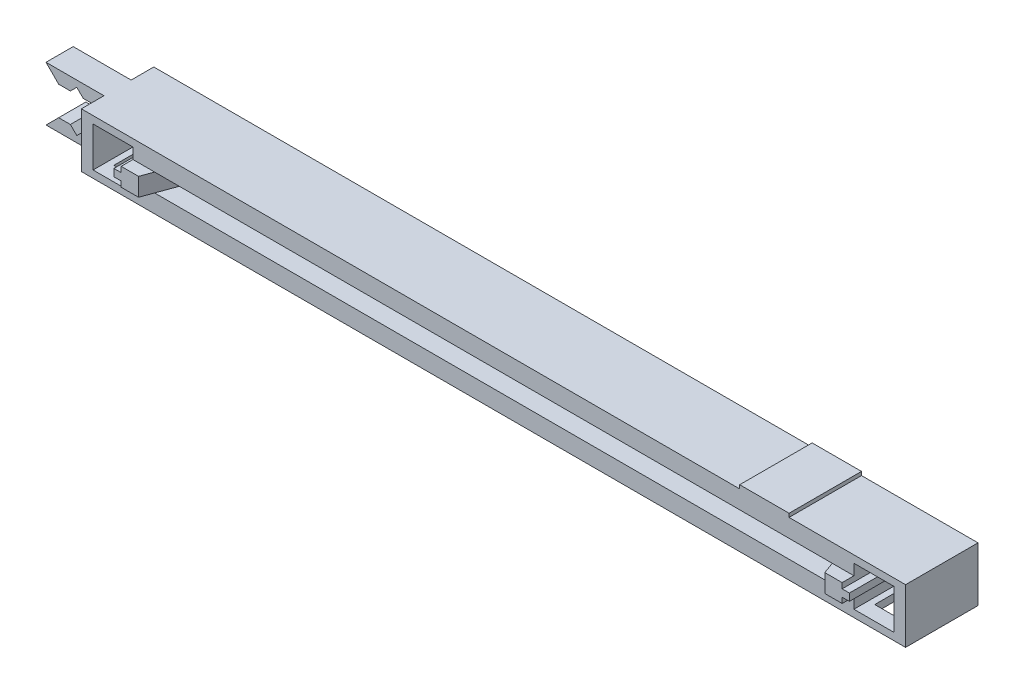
SolidWorks part; units mm, degrees
ref_plane "前视基准面" through (0, 0, 0) normal (0, 0, 1) x (1, 0, 0)
ref_plane "上视基准面" through (0, 0, 0) normal (0, 1, 0) x (1, 0, 0)
ref_plane "右视基准面" through (0, 0, 0) normal (1, 0, 0) x (0, 0, -1)
sketch "草图1" plane through (0, 0, 0) normal (0, 0, 1) x (1, 0, 0)
  line L1 (17.5, 15) -> (-17.5, 15)
  line L2 (17.5, 15) -> (17.5, -15)
  line L3 (17.5, -15) -> (-17.5, -15)
  line L4 (-17.5, 15) -> (-17.5, -15)
  line L5 (17.5, 15) -> (-17.5, -15) construction
  line L6 (17.5, -15) -> (-17.5, 15) construction
  point P0 (0, 0)
  dimension "D1" = 30
  dimension "D2" = 35
extrude "凸台-拉伸1" add sketch "草图1" along normal mid plane 40
sketch "草图2" plane through (-17.5, 0, 0) normal (-1, 0, 0) x (0, 0, 1)
  line L1 (7.5, 7.5) -> (-7.5, 7.5)
  line L2 (7.5, 7.5) -> (7.5, -7.5)
  line L3 (7.5, -7.5) -> (-7.5, -7.5)
  line L4 (-7.5, 7.5) -> (-7.5, -7.5)
  line L5 (7.5, 7.5) -> (-7.5, -7.5) construction
  line L6 (7.5, -7.5) -> (-7.5, 7.5) construction
  point P0 (0, 0)
  dimension "D1" = 15
  dimension "D2" = 15
extrude "凸台-拉伸2" add sketch "草图2" along normal blind 385
sketch "草图3" plane through (-402.5, 0, 0) normal (-1, 0, 0) x (0, 0, 1)
  line L4 (-20, 15) -> (-20, -15)
  line L5 (-20, -15) -> (20, -15)
  line L6 (20, -15) -> (20, 15)
  line L7 (20, 15) -> (-20, 15)
  line L8 (-20, 15) -> (-20, -15)
  line L9 (-20, -15) -> (20, -15)
  line L10 (20, -15) -> (20, 15)
  line L11 (20, 15) -> (-20, 15)
  dimension "D1" = 0
extrude "凸台-拉伸3" add sketch "草图3" along normal blind 35
sketch "草图4" plane through (0, 0, 20) normal (0, 0, 1) x (1, 0, 0)
  line L1 (11, 11) -> (-11, 11)
  line L2 (11, 11) -> (11, -11)
  line L3 (11, -11) -> (-11, -11)
  line L4 (-11, 11) -> (-11, -11)
  line L5 (11, 11) -> (-11, -11) construction
  line L6 (11, -11) -> (-11, 11) construction
  point P0 (0, 0)
  dimension "D1" = 22
  dimension "D2" = 22
extrude "切除-拉伸1" cut sketch "草图4" against normal blind 40
sketch "草图5" plane through (0, 0, 20) normal (0, 0, 1) x (1, 0, 0)
  line L0 (-437.5, 15) -> (-402.5, 15) construction
  line L1 (-409, 11) -> (-431, 11)
  line L2 (-409, 11) -> (-409, -11)
  line L3 (-409, -11) -> (-431, -11)
  line L4 (-431, 11) -> (-431, -11)
  line L5 (-409, 11) -> (-431, -11) construction
  line L6 (-409, -11) -> (-431, 11) construction
  line L7 (-437.5, -15) -> (-437.5, 15) construction
  point P0 (-420, 0)
  dimension "D1" = 22
  dimension "D2" = 22
  dimension "D3" = 4
  dimension "D4" = 6.5
extrude "切除-拉伸2" cut sketch "草图5" against normal blind 40
sketch "草图7" plane through (0, -15, 0) normal (0, -1, 0) x (1, 0, 0)
  line L1 (-420, 20) -> (-420, -20) construction
  line L2 (-437.5, 20) -> (-402.5, 20) construction
  line L3 (-437.5, -20) -> (-402.5, -20) construction
  line L5 (-412.5, 12) -> (-427.5, 12)
  line L6 (-412.5, 12) -> (-412.5, -12)
  line L7 (-412.5, -12) -> (-427.5, -12)
  line L8 (-427.5, 12) -> (-427.5, -12)
  line L9 (-412.5, 12) -> (-427.5, -12) construction
  line L10 (-412.5, -12) -> (-427.5, 12) construction
  point P0 (-420, 0)
  dimension "D1" = 8
  dimension "D2" = 15
extrude "切除-拉伸4" cut sketch "草图7" against normal blind 10
sketch "草图8" plane through (0, 0, 0) normal (0, 1, 0) x (1, 0, 0)
  line L0 (-392.5, 7.5) -> (-399.4154, 26.5)
  line L1 (-402.5, 7.5) -> (-17.5, 7.5) construction
  line L2 (-399.4154, 26.5) -> (-409, 26.5)
  line L3 (-409, 26.5) -> (-409, 20)
  line L4 (-437.5, 20) -> (-402.5, 20) construction
  line L5 (-409, 20) -> (-402.5, 20)
  line L6 (-402.5, 20) -> (-402.5, 7.5)
  line L7 (-402.5, 7.5) -> (-392.5, 7.5)
  dimension "D1" = 6.5
  dimension "D2" = 10
  dimension "D3" = 70
  dimension "D4" = 6.5
extrude "凸台-拉伸4" add sketch "草图8" along normal mid plane 10
mirror "镜向1" about plane through (0, 0, 0) normal (0, 0, 1) of "凸台-拉伸4"
ref_plane "基准面1" through (-210, 0, 0) normal (1, 0, 0) x (0, 0, -1)
mirror "镜向2" about plane through (-210, 0, 0) normal (1, 0, 0) of "镜向1", "凸台-拉伸4", "切除-拉伸4"
sketch "草图9" plane through (0, 0, 0) normal (0, 0, 1) x (1, 0, 0)
  line L0 (-437.5, -15) -> (-469.5, -15)
  line L1 (-469.5, -15) -> (-462.5, -8)
  line L2 (-462.5, -8) -> (-456.0355, -8)
  line L3 (-456.0355, -8) -> (-452.5, -11.5355)
  line L4 (-452.5, -11.5355) -> (-448.9645, -8)
  line L5 (-448.9645, -8) -> (-444.5, -8)
  line L6 (-444.5, -8) -> (-441.5, -5)
  line L7 (-441.5, -5) -> (-437.5, -5)
  line L8 (-437.5, -15) -> (-437.5, 15) construction
  line L9 (-437.5, -5) -> (-437.5, -15)
  line L10 (-437.5, 0) -> (-486.6165, 0) construction
  line L11 (-437.5, 5) -> (-437.5, 15)
  line L12 (-441.5, 5) -> (-437.5, 5)
  line L13 (-444.5, 8) -> (-441.5, 5)
  line L14 (-448.9645, 8) -> (-444.5, 8)
  line L15 (-452.5, 11.5355) -> (-448.9645, 8)
  line L16 (-456.0355, 8) -> (-452.5, 11.5355)
  line L17 (-462.5, 8) -> (-456.0355, 8)
  line L18 (-469.5, 15) -> (-462.5, 8)
  line L19 (-437.5, 15) -> (-469.5, 15)
  dimension "D1" = 10
  dimension "D2" = 7
  dimension "D3" = 7
  dimension "D4" = 90
  dimension "D5" = 135
  dimension "D6" = 32
  dimension "D7" = 15
  dimension "D8" = 5
  dimension "D9" = 4
extrude "凸台-拉伸5" add sketch "草图9" along normal mid plane 15
sketch "草图10" plane through (0, 0, 26.5) normal (0, 0, 1) x (1, 0, 0)
  line L0 (-409, 5) -> (-409, -5) construction
  line L1 (-405, 2) -> (-413, 2)
  line L2 (-405, 2) -> (-405, -2)
  line L3 (-405, -2) -> (-413, -2)
  line L4 (-413, 2) -> (-413, -2)
  line L5 (-405, 2) -> (-413, -2) construction
  line L6 (-405, -2) -> (-413, 2) construction
  point P0 (-409, 0)
  dimension "D1" = 8
  dimension "D2" = 4
extrude "凸台-拉伸6" add sketch "草图10" against normal up to surface (53 mm away)
mirror "镜向3" about plane through (-210, 0, 0) normal (1, 0, 0) of "凸台-拉伸6", "凸台-拉伸5"
sketch "草图11" plane through (-17.5, 0, 0) normal (-1, 0, 0) x (0, 0, 1)
  line L1 (20, 5) -> (20, 15) construction
  line L2 (20, 15) -> (-20, 15) construction
  line L3 (-20, 15) -> (-20, 5) construction
  line L8 (20, -15) -> (20, -5) construction
  line L14 (-20, -5) -> (-20, -15) construction
  line L15 (-20, -15) -> (20, -15) construction
  line L17 (20, 5) -> (20, 15)
  line L18 (20, 15) -> (-20, 15)
  line L19 (-20, 15) -> (-20, 5)
  line L24 (20, -15) -> (20, -5)
  line L30 (-20, -5) -> (-20, -15)
  line L31 (-20, -15) -> (20, -15)
  line L32 (18.5, 5) -> (18.5, 13.5)
  line L33 (18.5, 13.5) -> (-18.5, 13.5)
  line L34 (-18.5, 13.5) -> (-18.5, 5)
  line L35 (-18.5, -5) -> (-18.5, -13.5)
  line L36 (-18.5, -13.5) -> (18.5, -13.5)
  line L37 (18.5, -13.5) -> (18.5, -5)
  line L38 (-20, 5) -> (-18.5, 5)
  line L39 (-18.5, -5) -> (-20, -5)
  line L40 (18.5, -5) -> (20, -5)
  line L41 (18.5, 5) -> (20, 5)
  line L42 (-7.5, 5) -> (-18.5, 11)
  line L43 (-7.5, 7.5) -> (-18.5, 13.5)
  line L44 (-7.5, 7.5) -> (-7.5, 5)
  line L45 (0, 0) -> (0, 7.5) construction
  line L46 (7.5, 7.5) -> (-7.5, 7.5) construction
  line L47 (0, 0) -> (7.5, 0) construction
  line L48 (7.5, 5) -> (7.5, -5) construction
  line L49 (7.5, 7.5) -> (7.5, 5)
  line L50 (7.5, 7.5) -> (18.5, 13.5)
  line L51 (7.5, 5) -> (18.5, 11)
  line L52 (7.5, -7.5) -> (18.5, -13.5)
  line L53 (7.5, -7.5) -> (7.5, -5)
  line L54 (7.5, -5) -> (18.5, -11)
  line L55 (-7.5, -7.5) -> (-18.5, -13.5)
  line L56 (-7.5, -7.5) -> (-7.5, -5)
  line L57 (-7.5, -5) -> (-18.5, -11)
  dimension "D1" = 1.5
extrude "凸台-拉伸7" add sketch "草图11" along normal up to surface (385 mm away) contours L37 L36 L35 M16 M17 M18 M11 M12 | L54 L52 L37 M13 | L57 L35 L55 M15 | L49 L51 L32 L50 | L32 L41 L17 L18 L19 L38 L34 L33 | L44 L43 L34 L42
sketch "草图12" plane through (-402.5, 0, 0) normal (1, 0, 0) x (0, 0, -1)
  line L0 (-20, 5) -> (-5.119, 5)
  line L1 (-5.119, 5) -> (-5.119, 6.5)
  line L2 (-5.119, 6.5) -> (-20, 6.5)
  line L3 (-20, 5) -> (-20, 11) construction
  line L4 (-20, 6.5) -> (-20, 5)
  line L5 (0, 0) -> (0, 22.9298) construction
  line L6 (0, 0) -> (41.8153, 0) construction
  line L7 (20, 6.5) -> (20, 5)
  line L8 (5.119, 6.5) -> (20, 6.5)
  line L9 (5.119, 5) -> (5.119, 6.5)
  line L10 (20, 5) -> (5.119, 5)
  line L11 (20, -5) -> (5.119, -5)
  line L12 (5.119, -5) -> (5.119, -6.5)
  line L13 (5.119, -6.5) -> (20, -6.5)
  line L14 (20, -6.5) -> (20, -5)
  line L15 (-20, -6.5) -> (-20, -5)
  line L16 (-5.119, -6.5) -> (-20, -6.5)
  line L17 (-5.119, -5) -> (-5.119, -6.5)
  line L18 (-20, -5) -> (-5.119, -5)
  dimension "D1" = 1.5
extrude "凸台-拉伸8" add sketch "草图12" along normal up to next
sketch "草图13" plane through (0, 15, 0) normal (0, 1, 0) x (1, 0, 0)
  line L0 (17.5, 20) -> (-437.5, 20) construction
  line L1 (-46.8036, 20) -> (-74.0588, 20)
  line L2 (-46.8036, 20) -> (-46.8036, -20)
  line L3 (-46.8036, -20) -> (-74.0588, -20)
  line L4 (-74.0588, 20) -> (-74.0588, -20)
  line L5 (17.5, -20) -> (-437.5, -20) construction
extrude "凸台-拉伸9" add sketch "草图13" along normal blind 2
sketch "草图14" plane through (0, 0, 7.5) normal (0, 0, 1) x (1, 0, 0)
  line L1 (17.5, 15) -> (61.1724, 15)
  line L2 (17.5, 15) -> (17.5, -23.9717)
  line L3 (17.5, -23.9717) -> (61.1724, -23.9717)
  line L4 (61.1724, 15) -> (61.1724, -23.9717)
extrude "切除-拉伸5" cut sketch "草图14" against normal through all
